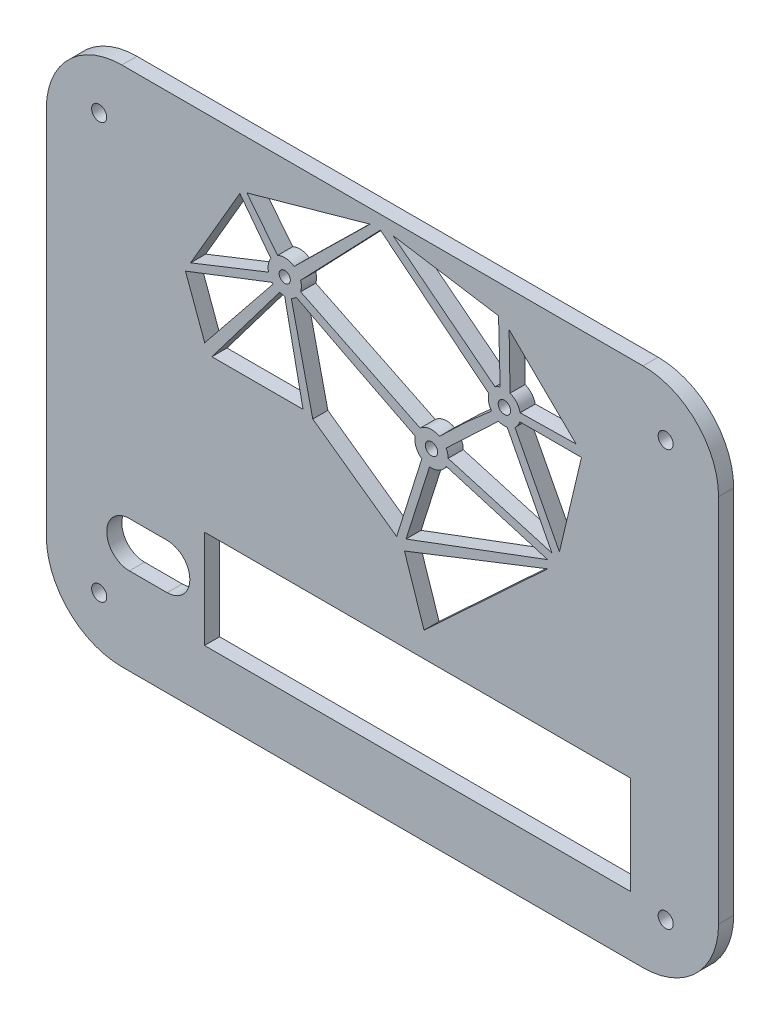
SolidWorks part; units mm, degrees
ref_plane "前视基准面" through (0, 0, 0) normal (0, 0, 1) x (1, 0, 0)
ref_plane "上视基准面" through (0, 0, 0) normal (0, 1, 0) x (1, 0, 0)
ref_plane "右视基准面" through (0, 0, 0) normal (1, 0, 0) x (0, 0, -1)
sketch "草图1" plane through (0, 0, 0) normal (0, 0, 1) x (1, 0, 0)
  line L0 (10, 0) -> (10, -10)
  line L1 (10, 0) -> (79, 0)
  line L2 (0, -10) -> (0, -59)
  line L3 (10, -69) -> (79, -69)
  line L4 (89, -10) -> (89, -59)
  line L5 (10, -10) -> (0, -10)
  line L6 (44.5, 0) -> (44.5, -69) construction
  line L7 (0, -34.5) -> (89, -34.5)
  line L8 (79, -10) -> (89, -10)
  line L9 (79, 0) -> (79, -10)
  line L10 (79, -59) -> (89, -59)
  line L11 (79, -69) -> (79, -59)
  line L12 (10, -59) -> (0, -59)
  line L13 (10, -69) -> (10, -59)
  arc A0 (79, 0) -> (89, -10) centre (79, -10) cw
  arc A1 (0, -59) -> (10, -69) centre (10, -59) ccw
  arc A2 (79, -69) -> (89, -59) centre (79, -59) ccw
  arc A3 (10, 0) -> (0, -10) centre (10, -10) ccw
  circle A4 centre (7, -7) radius 1
  circle A5 centre (82, -7) radius 1
  circle A6 centre (82, -62) radius 1
  circle A7 centre (7, -62) radius 1
  point P7 (89, 0)
  point P10 (0, -69)
  point P15 (0, 0)
  dimension "D3" = 10
  dimension "D5" = 3
  dimension "D6" = 2
  dimension "D1" = 89
  dimension "D2" = 69
  dimension "D4" = 3
extrude "凸台-拉伸1" add sketch "草图1" against normal blind 2 contours L6 L1 L0 L5 L2 L7 | L1 L6 L7 L4 L8 L9 | L6 L7 L2 L12 L13 L3 | L7 L6 L3 L11 L10 L4 | L0 A3 L5 A4 | A0 L9 L8 A5 | L12 A1 L13 A7 | L11 A2 L10 A6
sketch "草图2" plane through (0, 0, 0) normal (0, 0, 1) x (1, 0, 0)
  line L0 (11, -54.5) -> (16, -54.5) construction
  line L1 (11, -51.5) -> (16, -51.5)
  line L2 (11, -57.5) -> (16, -57.5)
  line L3 (10, -69) -> (79, -69) construction
  line L4 (0, -10) -> (0, -59) construction
  arc A0 (11, -51.5) -> (11, -57.5) centre (11, -54.5) ccw
  arc A1 (16, -57.5) -> (16, -51.5) centre (16, -54.5) ccw
  point P2 (13.5, -54.5)
  dimension "D1" = 3
  dimension "D4" = 11
  dimension "D2" = 5
  dimension "D3" = 11.5
extrude "切除-拉伸1" cut sketch "草图2" against normal up to next
sketch "草图3" plane through (0, 0, 0) normal (0, 0, 1) x (1, 0, 0)
  line L1 (20.9383, -48.0843) -> (77.3645, -48.0843)
  line L2 (20.9383, -48.0843) -> (20.9383, -61.0843)
  line L3 (20.9383, -61.0843) -> (77.3645, -61.0843)
  line L4 (77.3645, -48.0843) -> (77.3645, -61.0843)
  dimension "D2" = 13
extrude "切除-拉伸2" cut sketch "草图3" against normal up to next contours L2 L1 L4 L3
sketch "草图4" plane through (0, 0, 0) normal (0, 0, 1) x (1, 0, 0)
  line L0 (25.6244, -6.9111) -> (29.7197, -12.3051)
  line L1 (26.5518, -6.3875) -> (30.6179, -11.5185)
  line L2 (25.6244, -6.9111) -> (19.101, -18.132)
  line L3 (19.101, -18.132) -> (29.4278, -14.0409)
  line L4 (26.5518, -6.3875) -> (42.8576, -1.8193)
  line L5 (42.8576, -1.8193) -> (32.8106, -11.6883)
  line L6 (18.4211, -19.4183) -> (29.9149, -14.9677)
  line L7 (18.4211, -19.4183) -> (20.9713, -26.3652)
  line L8 (20.9713, -26.3652) -> (30.0323, -15.0907)
  line L9 (21.9198, -27.4878) -> (30.8941, -15.6073)
  line L10 (21.9198, -27.4878) -> (33.9876, -27.4878)
  line L11 (33.9876, -27.4878) -> (31.5541, -15.7124)
  line L12 (32.4353, -15.5341) -> (35.2736, -27.9534)
  line L13 (35.2736, -27.9534) -> (46.3811, -35.876)
  line L14 (46.3811, -35.876) -> (49.7127, -25.296)
  line L15 (39.6704, -18.4897) -> (33.1011, -15.0907)
  line L16 (39.6704, -18.4897) -> (48.822, -23.1238)
  line L17 (47.6195, -35.5412) -> (50.7365, -25.691)
  line L18 (47.6195, -35.5412) -> (66.3819, -28.5249)
  line L19 (66.3819, -28.5249) -> (52.9329, -24.5473)
  line L20 (47.4144, -37.0128) -> (66.3819, -29.5739)
  line L21 (66.3819, -29.5739) -> (50.0027, -44.7963)
  line L22 (50.0027, -44.7963) -> (47.4144, -37.0128)
  line L23 (66.9445, -27.4878) -> (53.1964, -23.5024)
  line L24 (66.9445, -27.4878) -> (61.0144, -16.0233)
  line L25 (52.9329, -22.4574) -> (59.8706, -15.9107)
  line L26 (67.9309, -26.8708) -> (62.0387, -15.5341)
  line L27 (67.9309, -26.8708) -> (70.8487, -14.568)
  line L28 (70.8487, -14.568) -> (62.6719, -14.568)
  line L29 (70.1388, -13.3846) -> (62.7281, -13.5081)
  line L30 (70.1388, -13.3846) -> (61.27, -4.6985)
  line L31 (61.27, -4.6985) -> (61.3907, -11.9376)
  line L32 (59.8706, -3.8244) -> (60.0836, -11.8769)
  line L33 (59.8706, -3.8244) -> (45.889, -1.6089)
  line L34 (45.889, -1.6089) -> (59.404, -12.2002)
  line L35 (44.2254, -1.8193) -> (33.6682, -12.8427)
  line L36 (33.6682, -14.1736) -> (49.4921, -21.8888)
  line L37 (55.4908, -18.2369) -> (52.0361, -21.5614)
  line L38 (55.4908, -18.2369) -> (58.9414, -15.2049)
  line L39 (44.2254, -1.8193) -> (58.587, -13.3846)
  circle A0 centre (31.5667, -13.5081) radius 0.7405
  circle A1 centre (31.5667, -13.5081) radius 2.2043
  circle A2 centre (60.6432, -13.9289) radius 0.8201
  circle A3 centre (60.6432, -13.9289) radius 2.127
  circle A4 centre (50.9928, -23.5024) radius 0.8133
  circle A5 centre (50.9928, -23.5024) radius 2.2036
extrude "切除-拉伸3" cut sketch "草图4" against normal up to next contours A1 L5 L4 L1 | A1 L0 L2 L3 | A1 L6 L7 L8 | A1 L9 L10 L11 | A5 L16 L15 A1 L12 L13 L14 | A5 L37 L38 A3 L39 L35 A1 L36 | A3 L32 L33 L34 | A3 L26 L27 L28 | A3 L29 L30 L31 | A5 L23 L24 A3 L25 | A5 L17 L18 L19 | L22 L21 L20 | A0 | A4 | A2
